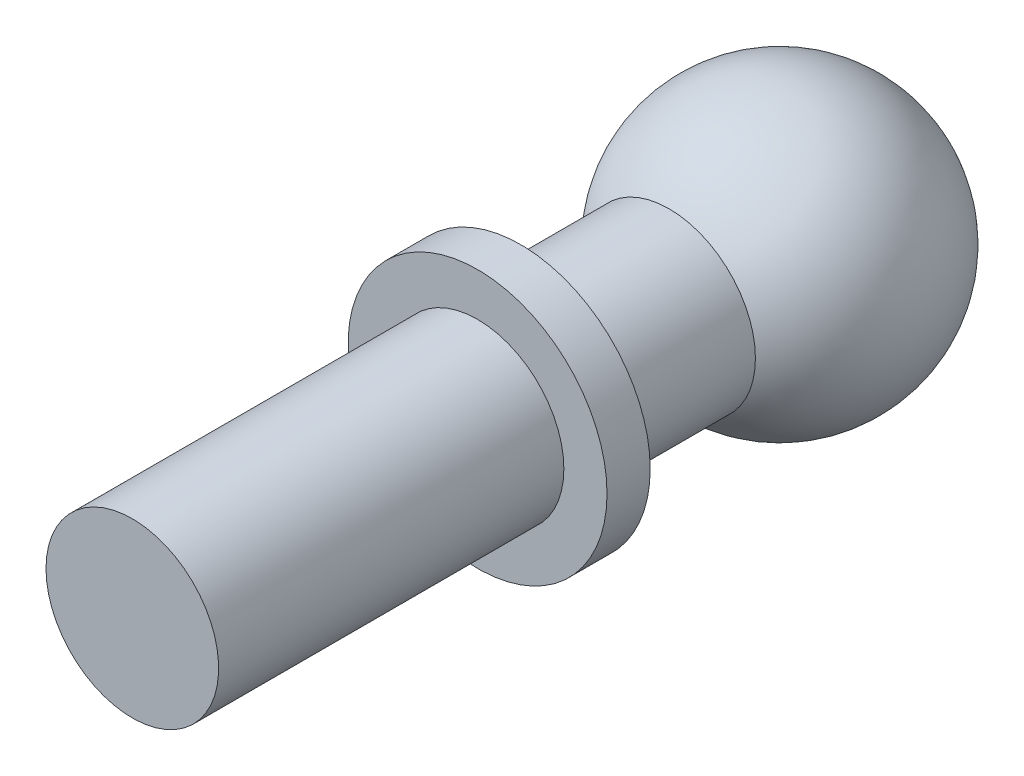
SolidWorks part; units mm, degrees
ref_plane "Front Plane" through (0, 0, 0) normal (0, 0, 1) x (1, 0, 0)
ref_plane "Top Plane" through (0, 0, 0) normal (0, 1, 0) x (1, 0, 0)
ref_plane "Right Plane" through (0, 0, 0) normal (1, 0, 0) x (0, 0, -1)
sketch "Sketch1" plane through (0, 0, 0) normal (0, 1, 0) x (1, 0, 0)
  line L0 (0, 6.5) -> (0, 0)
  line L1 (0, 0) -> (0, -30)
  line L2 (0, -30) -> (4, -30)
  line L3 (4, -30) -> (4, -5.1235)
  arc A0 (0, 6.5) -> (4, -5.1235) centre (0, 0) cw
  dimension "D1" = 30
  dimension "D3" = 6.5
  dimension "D2" = 4
revolve "Revolve1" add sketch "Sketch1" angle 360 about L1
sketch "Sketch2" plane through (0, 0, 30) normal (0, 0, 1) x (1, 0, 0)
  circle A0 centre (0, 0) radius 6
extrude "Boss-Extrude1" add sketch "Sketch2" against normal blind 2 from offset 16
